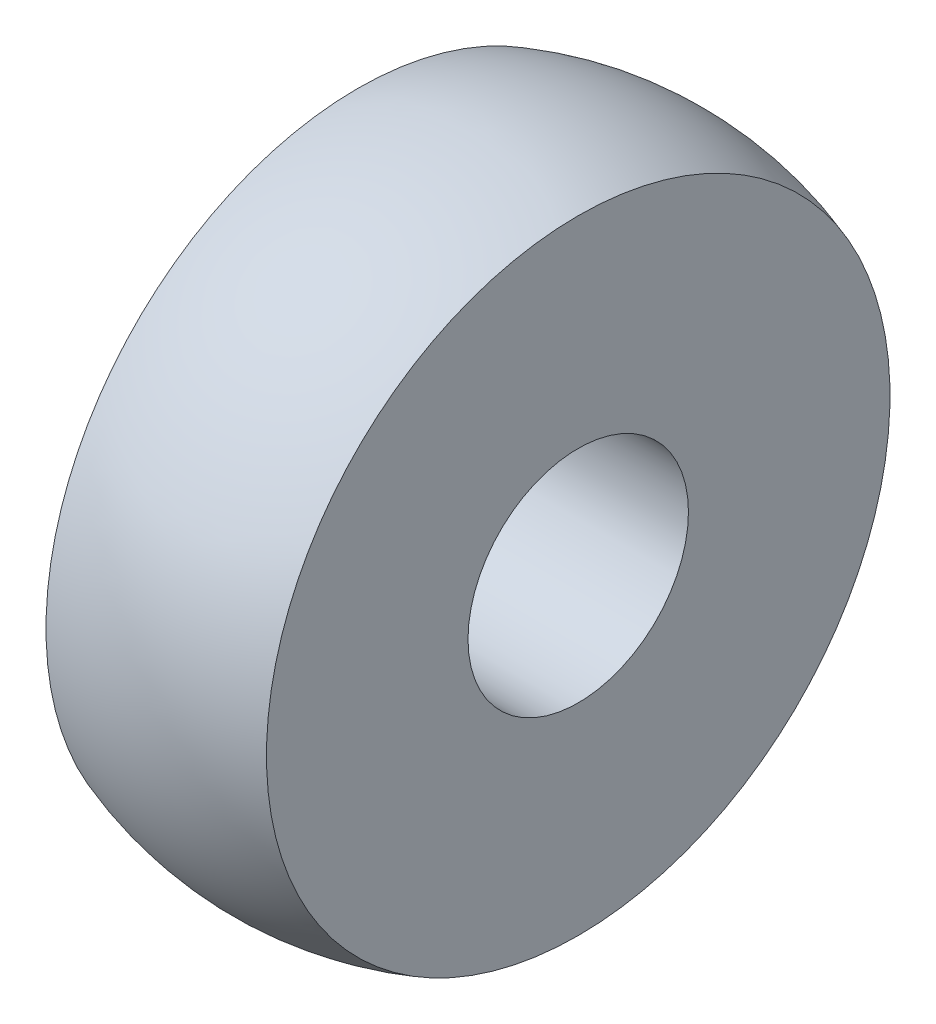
SolidWorks part; units mm, degrees
ref_plane "Front" through (0, 0, 0) normal (0, 0, 1) x (1, 0, 0)
ref_plane "Top" through (0, 0, 0) normal (0, 1, 0) x (1, 0, 0)
ref_plane "Right" through (0, 0, 0) normal (1, 0, 0) x (0, 0, -1)
sketch "Sketch1" plane through (0, 0, 0) normal (0, 0, 1) x (1, 0, 0)
  line L0 (-11.472, 0) -> (17.114, 0) construction
  line L1 (-6.35, 6.35) -> (6.35, 6.35)
  line L2 (6.35, 6.35) -> (6.35, 17.9605)
  line L3 (-6.35, 6.35) -> (-6.35, 17.9605)
  line L4 (0, -50) -> (0, 50) construction
  arc A0 (-6.35, 17.9605) -> (6.35, 17.9605) centre (0, 0) cw
  point P8 (0, 6.35)
  dimension "D1" = 12.7
  dimension "D2" = 12.7
  dimension "D3" = 38.1
revolve "Base-Revolve" add sketch "Sketch1" angle 360 about L0
